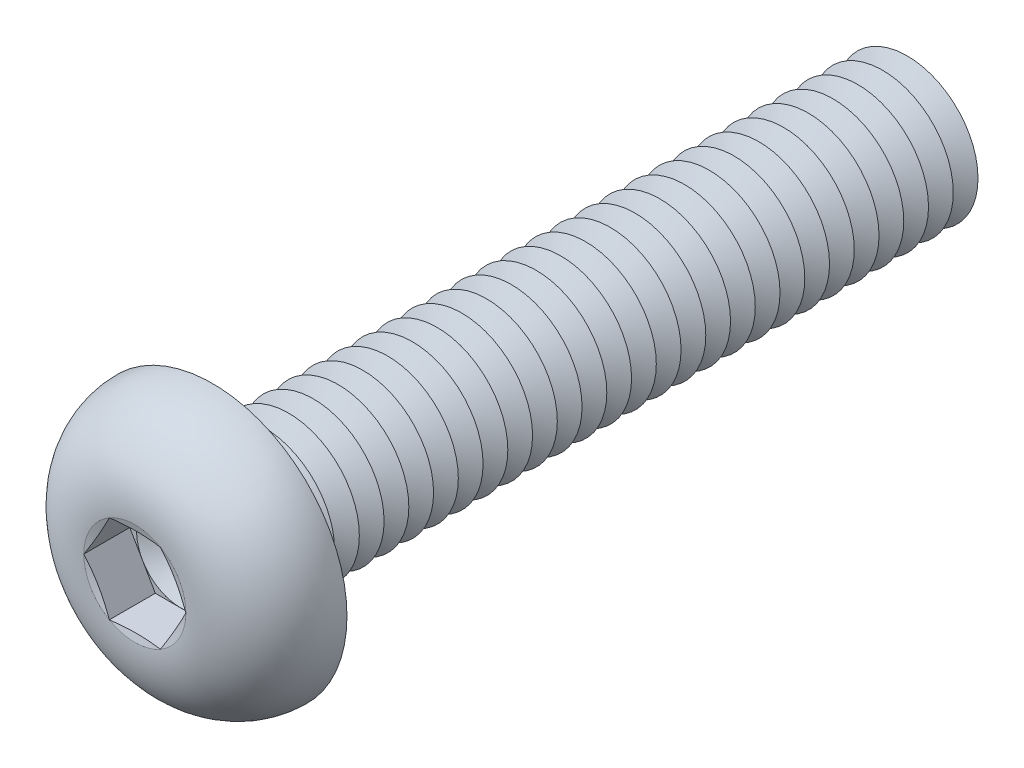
SolidWorks part; units mm, degrees
ref_plane "Front Plane" through (0, 0, 0) normal (0, 0, 1) x (1, 0, 0)
ref_plane "Top Plane" through (0, 0, 0) normal (0, 1, 0) x (1, 0, 0)
ref_plane "Right Plane" through (0, 0, 0) normal (1, 0, 0) x (0, 0, -1)
sketch "Sketch1" plane through (0, 0, 0) normal (1, 0, 0) x (0, 0, -1)
  line L0 (0, 2) -> (0, 3.8)
  line L3 (0, 2) -> (20, 2)
  line L4 (20, 2) -> (20, 0)
  line L5 (20, 0) -> (-2.2, 0) construction
  line L6 (-2.2, 0) -> (20, 0)
  line L7 (-2.2, 1.4434) -> (-2.2, 0.7217) construction
  line L8 (-2.2, 0.7217) -> (-2.2, 0)
  line L9 (-2.2, 1.4434) -> (-2.0066, 0.7217)
  line L10 (-2.0066, 0.7217) -> (-2.2, 0.7217)
  line L11 (20, 0) -> (22.7481, 0) construction
  line L12 (0, 3.8) -> (-2.2, 3.8) construction
  arc A1 (0, 3.8) -> (-2.2, 1.4434) centre (0, 1.5948) ccw
  point P8 (20, 1)
  dimension "D1" = 7.6
  dimension "D2" = 4
  dimension "D3" = 2.2
  dimension "D4" = 2.8868
  dimension "D5" = 20
  dimension "D6" = 15
revolve "Revolve1" add sketch "Sketch1" angle 360 about L5
fillet "Fillet1" radius 0.35 1 edges at (-2, 0, 0)
sketch "Sketch2" plane through (0, 0, 0) normal (1, 0, 0) x (0, 0, -1)
  line L0 (19.65, 2) -> (20.35, 2)
  line L1 (20, 2) -> (0.35, 2) construction
  line L2 (20.35, 2) -> (20, 1.3938)
  line L3 (20, -2) -> (20, 2) construction
  line L4 (20, 1.3938) -> (19.65, 2)
  dimension "D1" = 0.7
revolve "Cut-Revolve1" cut sketch "Sketch2" angle 360 about axis through (0, 0, -20) along (0, 0, -1)
pattern_linear "LPattern1" count 28 spacing 0.7 along (0, 0, 1) of "Cut-Revolve1"
sketch "Sketch3" plane through (0, 0, 2.2) normal (0, 0, 1) x (1, 0, 0)
  line L7 (0.7217, 1.25) -> (-0.7217, 1.25)
  line L8 (-0.7217, 1.25) -> (-1.4434, 0)
  line L9 (-1.4434, 0) -> (-0.7217, -1.25)
  line L10 (-0.7217, -1.25) -> (0.7217, -1.25)
  line L11 (0.7217, -1.25) -> (1.4434, 0)
  line L12 (1.4434, 0) -> (0.7217, 1.25)
  circle A0 centre (0, 0) radius 1.25 construction
  circle A3 centre (0, 0) radius 1.4434 construction
extrude "Cut-Extrude1" cut sketch "Sketch3" against normal blind 1.3
sketch "Sketch4" plane through (0, 0, 0.9) normal (0, 0, 1) x (1, 0, 0)
  line L1 (0.7217, 1.25) -> (-0.7217, 1.25) construction
  circle A0 centre (0, 0) radius 1.25
extrude "Cut-Extrude2" cut sketch "Sketch4" against normal through all draft 60
